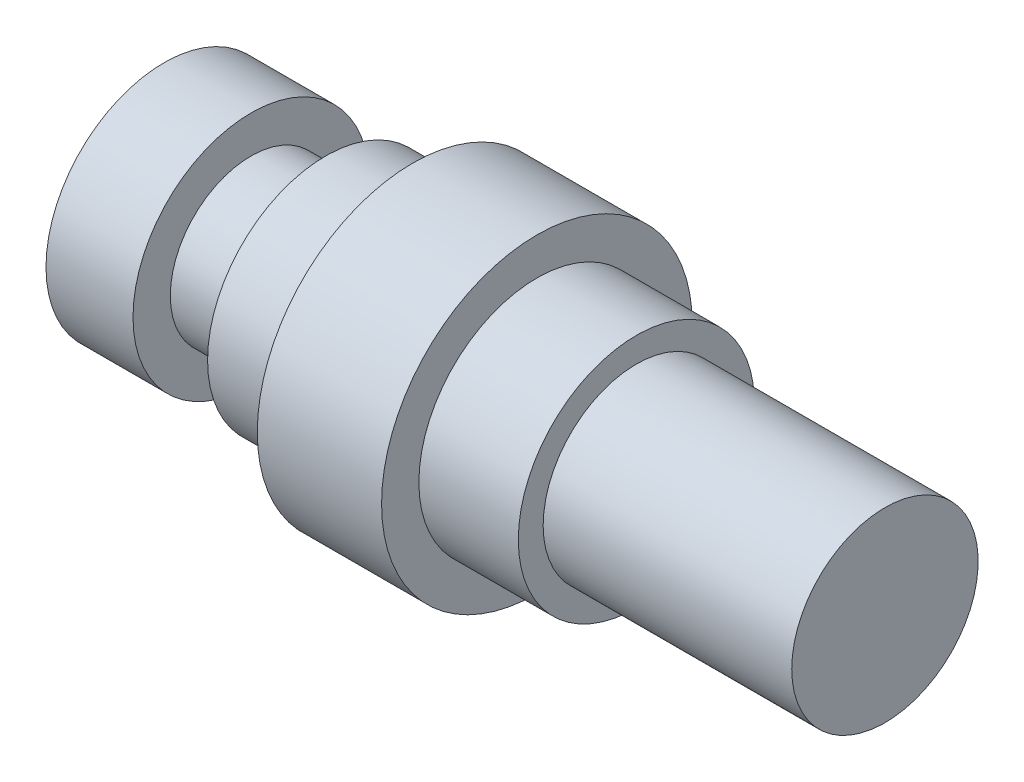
SolidWorks part; units mm, degrees
ref_plane "Front Plane" through (0, 0, 0) normal (0, 0, 1) x (1, 0, 0)
ref_plane "Top Plane" through (0, 0, 0) normal (0, 1, 0) x (1, 0, 0)
ref_plane "Right Plane" through (0, 0, 0) normal (1, 0, 0) x (0, 0, -1)
sketch "Sketch1" plane through (0, 0, 0) normal (0, 0, 1) x (1, 0, 0)
  line L0 (-78.0244, 0) -> (53.439, 0) construction
  line L1 (-70.6829, 0) -> (-70.6829, 9.5)
  line L2 (-70.6829, 9.5) -> (-63.6829, 9.5)
  line L3 (-63.6829, 9.5) -> (-63.6829, 6.5)
  line L4 (-63.6829, 6.5) -> (-57.6829, 6.5)
  line L5 (-57.6829, 6.5) -> (-57.6829, 9.5)
  line L6 (-57.6829, 9.5) -> (-50.6829, 9.5)
  line L7 (-50.6829, 9.5) -> (-50.6829, 12.5)
  line L8 (-50.6829, 12.5) -> (-40.6829, 12.5)
  line L9 (-40.6829, 12.5) -> (-40.6829, 9.5)
  line L10 (-40.6829, 9.5) -> (-32.6829, 9.5)
  line L11 (-12.6829, 7.5) -> (-12.6829, 0)
  line L12 (-12.6829, 0) -> (-70.6829, 0)
  line L13 (-32.6829, 9.5) -> (-32.6829, 7.5)
  line L14 (-32.6829, 7.5) -> (-12.6829, 7.5)
  dimension "D1" = 7
  dimension "D2" = 7
  dimension "D3" = 6
  dimension "D4" = 10
  dimension "D5" = 15
  dimension "D6" = 19
  dimension "D7" = 13
  dimension "D8" = 25
  dimension "D9" = 19
  dimension "D10" = 8
  dimension "D11" = 20
revolve "Revolve1" add sketch "Sketch1" angle 360 about L0
scale "Scale1" scale about centroid uniform scaling yes scale factor 0.75
